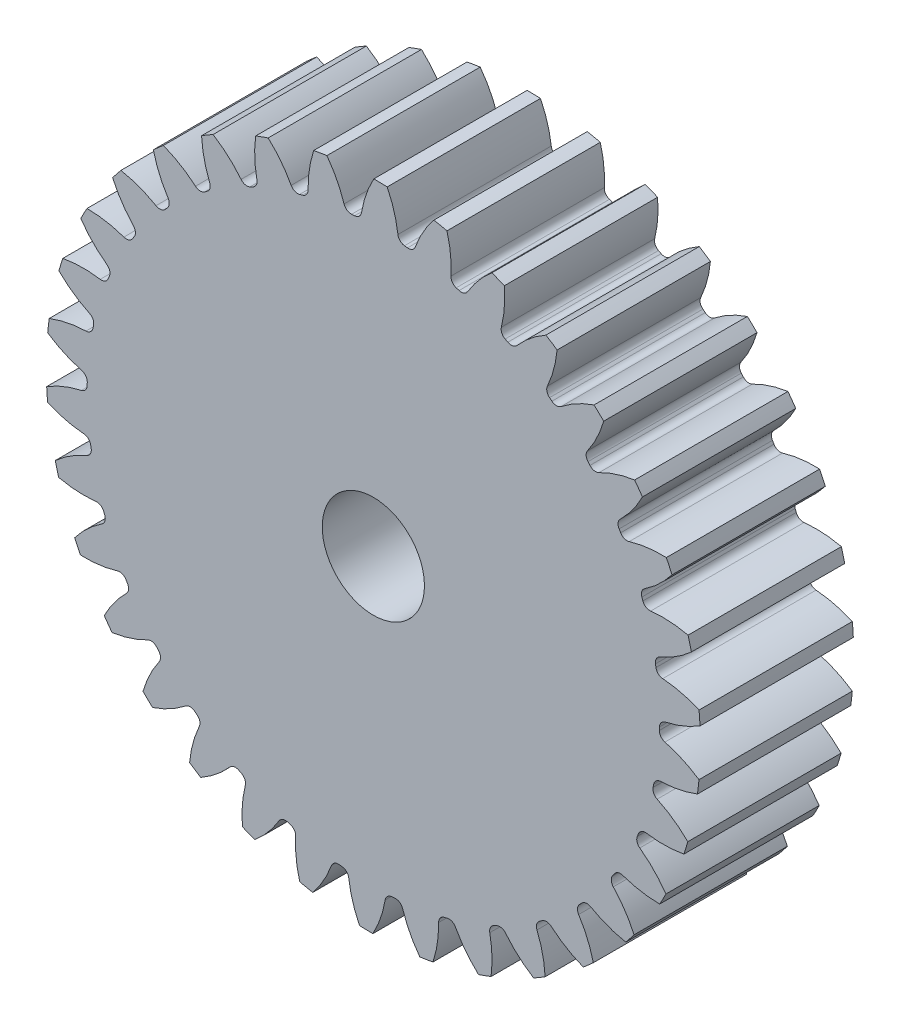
SolidWorks part; units mm, degrees
ref_plane "Front" through (0, 0, 0) normal (0, 0, 1) x (1, 0, 0)
ref_plane "Top" through (0, 0, 0) normal (0, 1, 0) x (1, 0, 0)
ref_plane "Right" through (0, 0, 0) normal (1, 0, 0) x (0, 0, -1)
sketch "Sketch3" plane through (0, 0, 0) normal (0, 0, 1) x (1, 0, 0)
  circle A0 centre (0, 0) radius 203.2
  dimension "od" = 406.4
extrude "gearBody" add sketch "Sketch3" along normal blind 95.25
sketch "Sketch2" plane through (0, 0, 0) normal (0, 0, 1) x (1, 0, 0)
  line L0 (0, 0) -> (166.6101, 69.0122) construction
  line L1 (202.5539, -19.2115) -> (0, 0) construction
  line L2 (0, 0) -> (36.3143, 0) construction
  line L3 (191.855, 4.6399) -> (191.469, -13.0198) construction
  line L5 (191.662, -4.1899) -> (0, 0) construction
  line L7 (0, 0) -> (180.3375, 0) construction
  arc A0 (180.3332, 1.2422) -> (180.1066, -9.1218) centre (0, 0) ccw construction
  arc A1 (202.9447, 10.1828) -> (202.3058, -19.0421) centre (0, 0) ccw construction
  arc A2 (191.855, 4.6399) -> (191.469, -13.0198) centre (0, 0) ccw construction
  arc A3 (177.7346, -4.8239) -> (177.7756, -2.948) centre (0, 0) ccw
  arc A4 (202.5539, -19.2115) -> (181.1503, -9.3897) centre (163.435, -76.2273) ccw
  arc A5 (202.5539, -19.2115) -> (203.2, 10.3413) centre (0, 0) ccw
  arc A6 (203.2, 10.3413) -> (181.3876, 1.4643) centre (166.6101, 69.0122) cw
  arc A7 (177.7756, -2.948) -> (181.3876, 1.4643) centre (182.3695, -3.0242) cw
  arc A8 (181.1503, -9.3897) -> (177.7346, -4.8239) centre (182.3274, -4.9485) cw
  point P6 (203.2, 10.3413)
  point P22 (202.5539, -19.2115)
  dimension "baseDia" = 360.6749
  dimension "od" = 406.4
  dimension "pd" = 383.8222
  dimension "rd" = 355.6
  dimension "rFillet" = 4.5946
  dimension "pointX" = 203.2
  dimension "pointY" = 10.3413
  dimension "CTT" = 17.6597
  dimension "flankCenterAngle" = 22.5
extrude "toothCut" cut sketch "Sketch2" along normal through all
pattern_circular "CirPattern1" count 34 over 360 about axis through (0, 0, 0) along (0, 0, 1) of "toothCut"
sketch "hub1Dia" plane through (0, 0, 0) normal (0, 0, -1) x (-1, 0, 0)
  circle A0 centre (0, 0) radius 12.7
  dimension "hub1Dia" = 25.4
sketch "hub2Dia" plane through (0, 0, 95.25) normal (0, 0, 1) x (1, 0, 0)
  circle A0 centre (0, 0) radius 12.7
  dimension "hub2dia" = 25.4
sketch "boreDia" plane through (0, 0, 0) normal (0, 0, 1) x (1, 0, 0)
  circle A0 centre (0, 0) radius 31.75
  dimension "boreDia" = 63.5
extrude "bore" cut sketch "boreDia" against normal mid plane 25400
